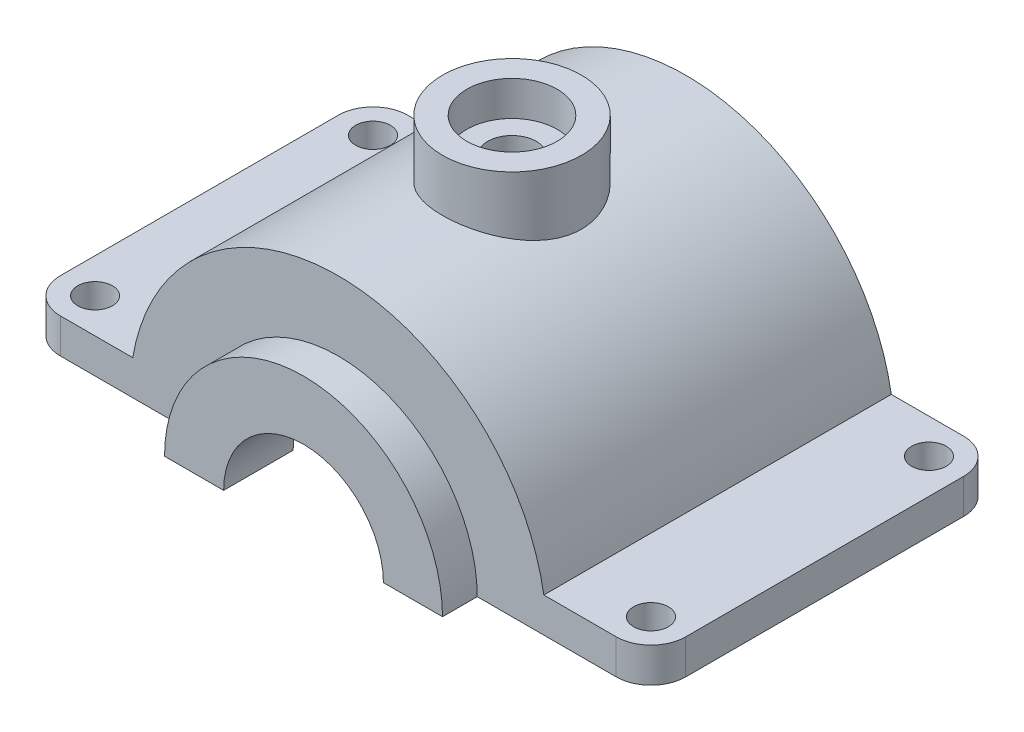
SolidWorks part; units mm, degrees
ref_plane "前视基准面" through (0, 0, 0) normal (0, 0, 1) x (1, 0, 0)
ref_plane "上视基准面" through (0, 0, 0) normal (0, 1, 0) x (1, 0, 0)
ref_plane "右视基准面" through (0, 0, 0) normal (1, 0, 0) x (0, 0, -1)
sketch "草图1" plane through (0, 0, 0) normal (0, 0, 1) x (1, 0, 0)
  line L0 (-71.4557, 0) -> (77.0759, 0) construction
  line L1 (59.1608, 10) -> (90, 10)
  line L2 (90, 10) -> (90, 0)
  line L3 (90, 0) -> (50, 0)
  line L4 (-59.1608, 10) -> (-90, 10)
  line L5 (-90, 10) -> (-90, 0)
  line L6 (-90, 0) -> (-50, 0)
  arc A0 (-50, 0) -> (50, 0) centre (0, 0) cw
  arc A1 (-59.1608, 10) -> (59.1608, 10) centre (0, 0) cw
  dimension "D1" = 50
  dimension "D2" = 60
  dimension "D3" = 10
  dimension "D4" = 40
  dimension "D5" = 40
  dimension "D6" = 10
extrude "拉伸1" add sketch "草图1" along normal mid plane 80
sketch "草图2" plane through (0, 0, 40) normal (0, 0, 1) x (1, 0, 0)
  line L0 (90, 0) -> (90, 10) construction
  line L1 (-90, 10) -> (-90, 0) construction
  line L2 (-59.1608, 10) -> (-90, 10) construction
  line L3 (90, 10) -> (59.1608, 10) construction
  line L4 (90, 0) -> (90, 10)
  line L5 (-90, 10) -> (-90, 0)
  line L6 (-59.1608, 10) -> (-90, 10)
  line L7 (90, 10) -> (59.1608, 10)
  line L8 (-90, 0) -> (90, 0)
  arc A0 (59.1608, 10) -> (-59.1608, 10) centre (0, 0) ccw construction
  arc A1 (59.1608, 10) -> (-59.1608, 10) centre (0, 0) ccw
extrude "拉伸2" add sketch "草图2" along normal blind 10
mirror "镜向1" about plane through (0, 0, 0) normal (0, 0, 1) of "拉伸2"
sketch "草图3" plane through (0, 0, 50) normal (0, 0, 1) x (1, 0, 0)
  line L0 (-90, 0) -> (90, 0) construction
  line L6 (-90, 0) -> (90, 0)
  line L7 (90, 0) -> (90, 10)
  line L8 (90, 10) -> (59.1608, 10)
  line L9 (-59.1608, 10) -> (-90, 10)
  line L10 (-90, 10) -> (-90, 0)
  line L11 (-40, 0) -> (40, 0)
  arc A0 (-40, 0) -> (40, 0) centre (0, 0) cw
  arc A2 (59.1608, 10) -> (-59.1608, 10) centre (0, 0) ccw
  dimension "D1" = 40
  dimension "D2" = 0
extrude "拉伸3" add sketch "草图3" along normal blind 10
sketch "草图4" plane through (0, 0, 60) normal (0, 0, 1) x (1, 0, 0)
  line L0 (-40, 0) -> (40, 0) construction
  line L1 (22.9885, 0) -> (-22.9885, 0)
  arc A0 (-22.9885, 0) -> (22.9885, 0) centre (0, 0) cw
extrude "切除-拉伸1" cut sketch "草图4" against normal blind 20
ref_plane "基准面1" through (0, 75, 0) normal (0, 1, 0) x (-1, 0, 0)
sketch "草图5" plane through (0, 75, 0) normal (0, 1, 0) x (-1, 0, 0)
  circle A0 centre (0, 0) radius 20
  dimension "D1" = 40
extrude "拉伸4" add sketch "草图5" against normal up to surface (15 mm away)
sketch "草图6" plane through (0, 75, 0) normal (0, 1, 0) x (1, 0, 0)
  circle A0 centre (0, 0) radius 7
  dimension "D1" = 14
extrude "切除-拉伸2" cut sketch "草图6" against normal through all
sketch "草图7" plane through (0, 75, 0) normal (0, 1, 0) x (1, 0, 0)
  circle A0 centre (0, 0) radius 13
  dimension "D1" = 26
extrude "切除-拉伸3" cut sketch "草图7" against normal blind 10
fillet "圆角1" radius 10 5 edges at (90, 5, 50) (-90, 5, 50) (-90, 5, -50) (90, 5, -50)
sketch "草图8" plane through (0, 10, 0) normal (0, 1, 0) x (1, 0, 0)
  circle A0 centre (80, 40) radius 5
  circle A1 centre (80, -40) radius 5
  arc A2 (90, 40) -> (80, 50) centre (80, 40) ccw construction
  arc A3 (80, -50) -> (90, -40) centre (80, -40) ccw construction
  dimension "D1" = 10
  dimension "D2" = 10
extrude "切除-拉伸4" cut sketch "草图8" against normal blind 10
mirror "镜向2" about plane through (0, 0, 0) normal (1, 0, 0) of "切除-拉伸4"
